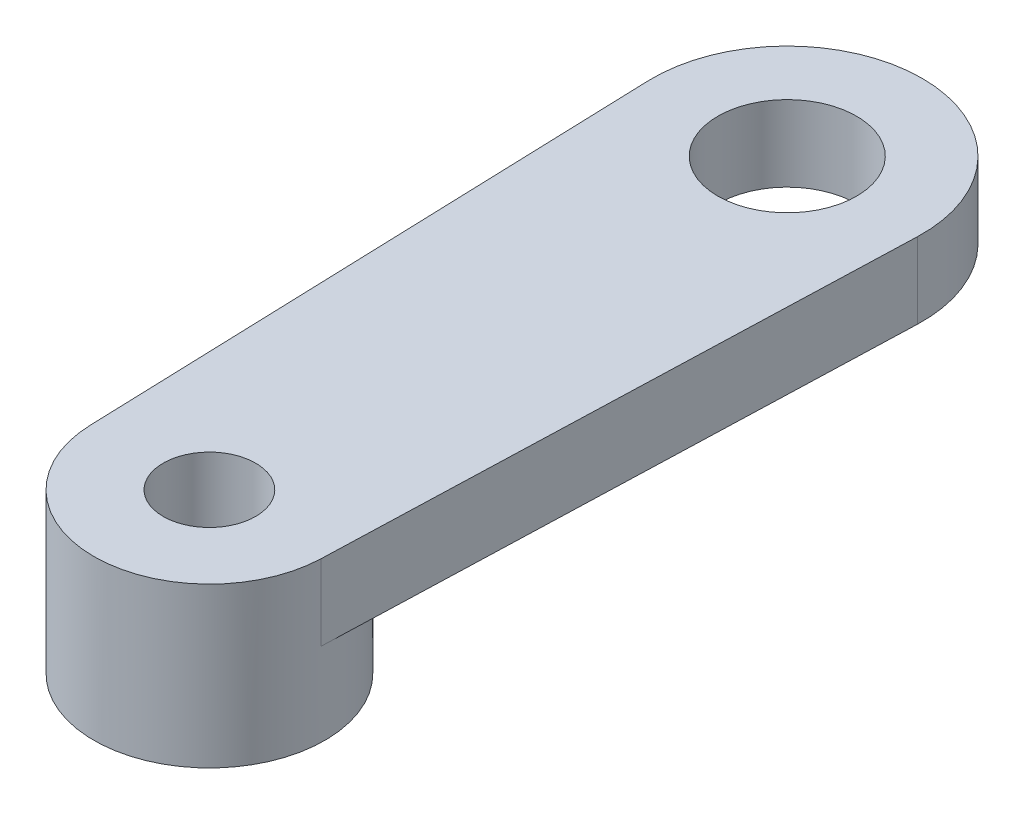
SolidWorks part; units mm, degrees
ref_plane "Frontal Plane" through (0, 0, 0) normal (0, 0, 1) x (1, 0, 0)
ref_plane "Horizontal Plane" through (0, 0, 0) normal (0, 1, 0) x (1, 0, 0)
ref_plane "Profile Plane" through (0, 0, 0) normal (1, 0, 0) x (0, 0, -1)
sketch "Sketch1" plane through (0, 0, 0) normal (0, 1, 0) x (1, 0, 0)
  line L0 (0, 0) -> (0, 19.05) construction
  line L1 (-3.8079, -0.1275) -> (-4.445, 18.9012)
  line L4 (4.445, 18.9012) -> (3.8079, -0.1275)
  circle A3 centre (0, 19.05) radius 2.286
  arc A4 (-4.445, 18.9012) -> (4.445, 18.9012) centre (0, 19.05) cw
  arc A5 (3.8079, -0.1275) -> (-3.8079, -0.1275) centre (0, 0) cw
  circle A6 centre (0, 0) radius 1.524
  dimension "D4" = 4.572
  dimension "D5" = 8.89
  dimension "D2" = 3.048
  dimension "D3" = 3.81
  dimension "D1" = 19.05
extrude "Boss-Extrude1" add sketch "Sketch1" along normal blind 2.5
sketch "Sketch2" plane through (0, 0, 0) normal (0, -1, 0) x (1, 0, 0)
  circle A0 centre (0, 0) radius 2.4486
  circle A1 centre (0, 0) radius 3.81
  arc A2 (3.8079, 0.1275) -> (-3.8079, 0.1275) centre (0, 0) ccw construction
  dimension "D1" = 4.8971
extrude "Boss-Extrude3" add sketch "Sketch2" along normal blind 2.75
